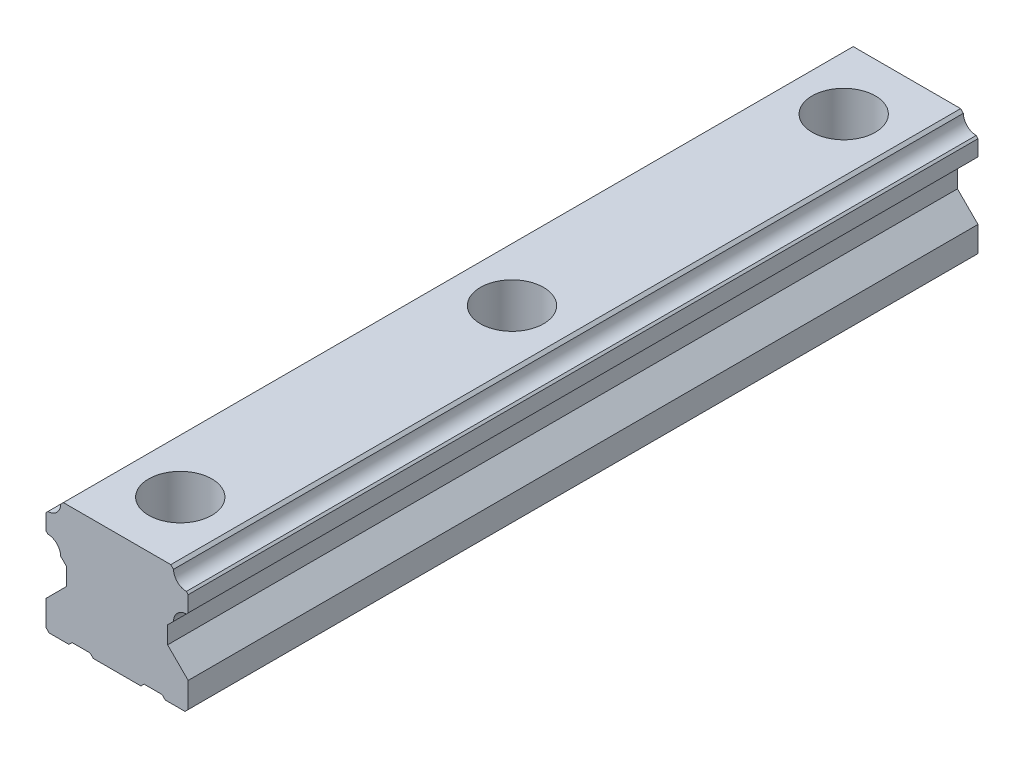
SolidWorks part; units mm, degrees
ref_plane "Front Plane" through (0, 0, 0) normal (0, 0, 1) x (1, 0, 0)
ref_plane "Top Plane" through (0, 0, 0) normal (0, 1, 0) x (1, 0, 0)
ref_plane "Right Plane" through (0, 0, 0) normal (1, 0, 0) x (0, 0, -1)
sketch "Sketch1" plane through (0, 0, 0) normal (0, 0, 1) x (1, 0, 0)
  line L0 (21.9072, 33.0928) -> (22.5, 32.5)
  line L1 (17, 38) -> (17.8608, 37.1392)
  line L2 (-17, 38) -> (17, 38)
  line L3 (-17.8608, 37.1392) -> (-17, 38)
  line L4 (-22.5, 32.5) -> (-21.9072, 33.0928)
  line L5 (-22.5, 27.5) -> (-22.5, 32.5)
  line L6 (-21.9092, 26.9092) -> (-22.5, 27.5)
  line L7 (-16, 21) -> (-17.8608, 22.8608)
  line L8 (-16, 15.5) -> (-16, 21)
  line L9 (-22.5, 9) -> (-16, 15.5)
  line L10 (-22.5, 1) -> (-22.5, 9)
  line L11 (-21.5, 0) -> (-22.5, 1)
  line L12 (-15.25, 0) -> (-21.5, 0)
  line L13 (-14.25, 1) -> (-15.25, 0)
  line L14 (-8.55, 1) -> (-14.25, 1)
  line L15 (-7.55, 0) -> (-8.55, 1)
  line L16 (7.55, 0) -> (-7.55, 0)
  line L17 (8.55, 1) -> (7.55, 0)
  line L18 (14.25, 1) -> (8.55, 1)
  line L19 (15.25, 0) -> (14.25, 1)
  line L20 (21.5, 0) -> (15.25, 0)
  line L21 (22.5, 1) -> (21.5, 0)
  line L22 (22.5, 9) -> (22.5, 1)
  line L23 (16, 15.5) -> (22.5, 9)
  line L24 (16, 21) -> (16, 15.5)
  line L25 (17.8608, 22.8608) -> (16, 21)
  line L26 (22.5, 27.5) -> (21.9092, 26.9092)
  line L27 (22.5, 32.5) -> (22.5, 27.5)
  arc A0 (17.8608, 37.1392) -> (21.9072, 33.0928) centre (21.99, 37.222) ccw
  arc A1 (-21.9072, 33.0928) -> (-17.8608, 37.1392) centre (-21.99, 37.222) ccw
  arc A2 (-17.8608, 22.8608) -> (-21.9092, 26.9092) centre (-21.99, 22.78) ccw
  arc A3 (21.9092, 26.9092) -> (17.8608, 22.8608) centre (21.99, 22.78) ccw
extrude "Boss-Extrude1" add sketch "Sketch1" against normal blind 250 contours L2 L1 A0 L0 L27 L26 A3 L25 L24 L23 L22 L21 L20 L19 L18 L17 L16 L15 L14 L13 L12 L11 L10 L9 L8 L7 A2 L6 L5 L4 A1 L3
hole_wizard "CBORE for M12 Hex Socket Head Cap Screw1" positions "Sketch2" profile "Sketch3" counterbore size "M12" standard "ISO"
sketch "Sketch2" plane through (0, 38, 0) normal (0, 1, 0) x (1, 0, 0)
  line L0 (-17, 0) -> (17, 0) construction
  point P0 (0, 20)
  dimension "D1" = 20
sketch "Sketch3" plane through (0, 38, -20) normal (1, 0, 0) x (0, 0, 1)
  line L0 (0, 0) -> (0, 38)
  line L1 (0, 38) -> (7, 38)
  line L3 (7, 38) -> (7, 17)
  line L4 (7, 17) -> (10, 17)
  line L5 (10, 17) -> (10, 0)
  line L7 (10, 0) -> (0, 0)
  line L11 (0, -6.35) -> (0, 107.95) construction
  dimension "Thru Hole Dia." = 14
  dimension "Thru Hole Depth" = 38
  dimension "C'Bore Dia." = 20
  dimension "C'Bore Depth" = 17
pattern_linear "LPattern1" count 3 spacing 105 along (0, 0, -1) of "CBORE for M12 Hex Socket Head Cap Screw1"
